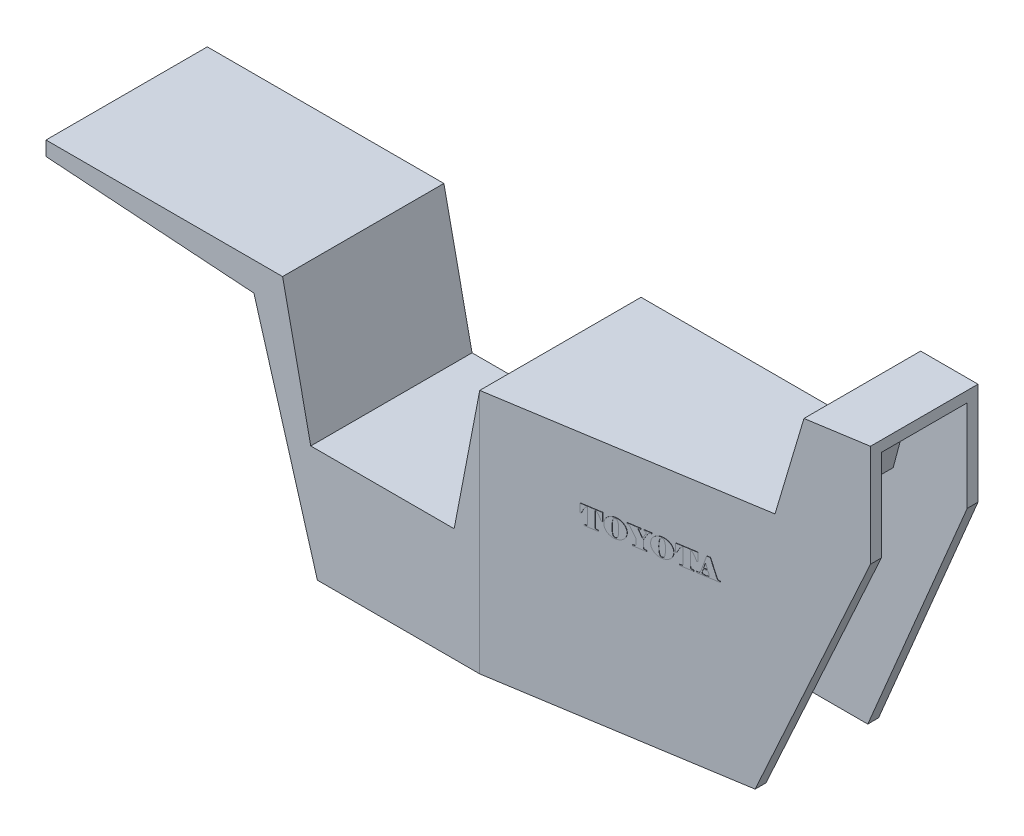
SolidWorks part; units mm, degrees
ref_plane "Front Plane" through (0, 0, 0) normal (0, 0, 1) x (1, 0, 0)
ref_plane "Top Plane" through (0, 0, 0) normal (0, 1, 0) x (1, 0, 0)
ref_plane "Right Plane" through (0, 0, 0) normal (1, 0, 0) x (0, 0, -1)
sketch "Sketch1" plane through (0, 0, 0) normal (0, 0, 1) x (1, 0, 0)
  line L0 (0, 0) -> (0, -285)
  line L1 (0, -285) -> (-277.494, -945)
  line L2 (-277.494, -945) -> (-1392.901, -945)
  line L3 (-1392.901, -945) -> (-1570, -340)
  line L4 (-1570, -340) -> (-2150, -300)
  line L5 (-2150, -300) -> (-2150, -260)
  line L6 (-2150, -260) -> (-1490, -260)
  line L7 (-1490, -260) -> (-1352.901, -905)
  line L8 (-1352.901, -905) -> (-402.494, -905)
  line L9 (-402.494, -905) -> (-160, 0)
  line L10 (-160, 0) -> (0, 0)
  dimension "D1" = 2150
  dimension "D2" = 160
  dimension "D3" = 285
  dimension "D4" = 945
  dimension "D5" = 685
  dimension "D6" = 40
  dimension "D7" = 125
  dimension "D8" = 105
  dimension "D9" = 660
  dimension "D10" = 40
  dimension "D11" = 80
  dimension "D12" = 80
  dimension "D13" = 102
  dimension "D14" = 40
extrude "Boss-Extrude1" add sketch "Sketch1" along normal blind 450
sketch "Sketch2" plane through (0, 0, 450) normal (0, 0, 1) x (1, 0, 0)
  line L0 (-1411.3694, -629.928) -> (-1011.3694, -629.928)
  line L1 (-1011.3694, -629.928) -> (-940, -260)
  line L2 (-940, -260) -> (-229.6668, -260)
  line L11 (0, 0) -> (-160, 0)
  line L12 (-160, 0) -> (-402.494, -905)
  line L13 (-402.494, -905) -> (-1352.901, -905)
  line L14 (-1352.901, -905) -> (-1490, -260)
  line L15 (-1490, -260) -> (-2150, -260)
  line L16 (-2150, -260) -> (-2150, -300)
  line L17 (-2150, -300) -> (-1570, -340)
  line L18 (-1570, -340) -> (-1392.901, -945)
  line L19 (-1392.901, -945) -> (-277.494, -945)
  line L20 (-277.494, -945) -> (0, -285)
  line L21 (0, -285) -> (0, 0)
  line L22 (0, 0) -> (-160, 0)
  line L23 (-229.6668, -260) -> (-402.494, -905)
  line L24 (-402.494, -905) -> (-1352.901, -905)
  line L25 (-1352.901, -905) -> (-1411.3694, -629.928)
  line L26 (-1490, -260) -> (-2150, -260)
  line L27 (-2150, -260) -> (-2150, -300)
  line L28 (-2150, -300) -> (-1570, -340)
  line L29 (-1570, -340) -> (-1392.901, -945)
  line L30 (-1392.901, -945) -> (-277.494, -945)
  line L31 (-277.494, -945) -> (0, -285)
  line L32 (0, -285) -> (0, 0)
  dimension "D2" = 550
  dimension "400" = 400
  dimension "D1" = 0
extrude "Boss-Extrude2" add sketch "Sketch2" against normal through all contours L2 L1 L0 M15 M14 M13
sketch "Sketch3" plane through (0, 0, 0) normal (0, 1, 0) x (1, 0, 0)
  line L0 (-940, -450) -> (0, -300)
  line L1 (0, -450) -> (0, 0) construction
  line L2 (0, -450) -> (0, -300)
  line L3 (0, -450) -> (-940, -450)
  dimension "150" = 150
extrude "Cut-Extrude1" cut sketch "Sketch3" against normal through all
shell "Shell1" thickness 30
sketch "Sketch8" plane through (46.6836, 0, 292.5505) normal (0.1576, 0, 0.9875) x (0.9875, 0, -0.1576)
  line L0 (-809.8468, -480) -> (-359.8468, -480) construction
  line L1 (-999.1671, -260) -> (-279.8468, -260) construction
  text T0 "TOYOTA  " font "Elephant" height 50
  dimension "D1" = 220
  dimension "D2" = 450
  dimension "D3" = 80
wrap "Wrap1" sketch "Sketch8" wrap type emboss source sketch "Sketch8" thickness 1 parameters "D1"=1
